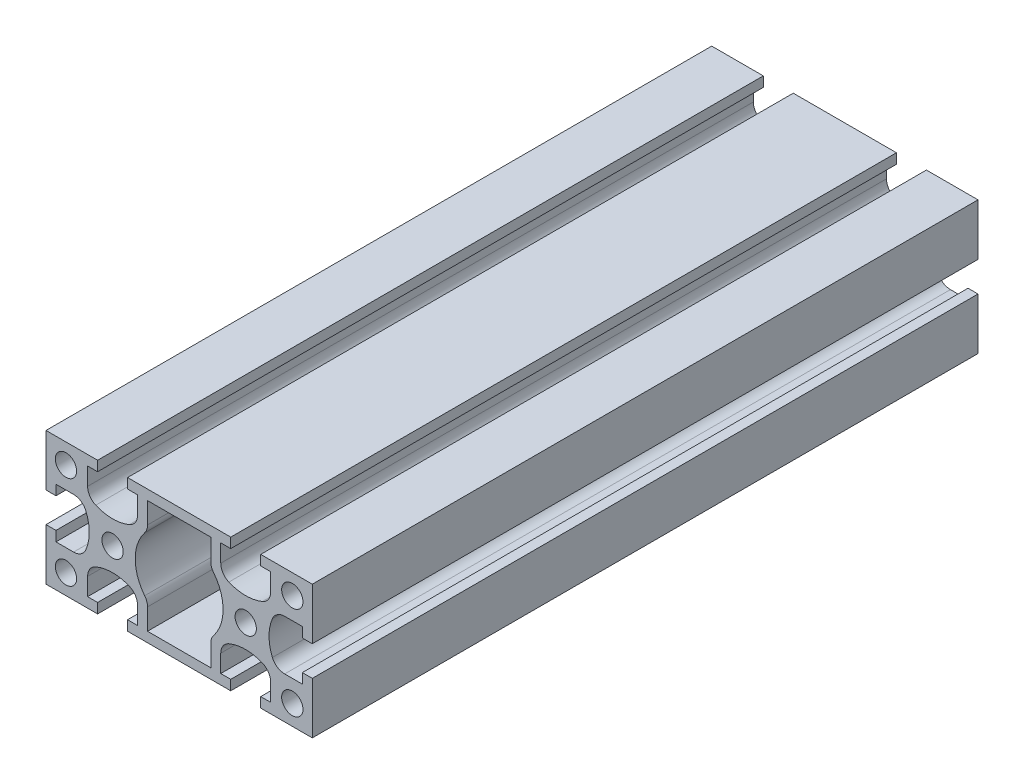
SolidWorks part; units mm, degrees
ref_plane "前基準面" through (0, 0, 0) normal (0, 0, 1) x (1, 0, 0)
ref_plane "上基準面" through (0, 0, 0) normal (0, 1, 0) x (1, 0, 0)
ref_plane "右基準面" through (0, 0, 0) normal (1, 0, 0) x (0, 0, -1)
sketch "草圖1" plane through (0, 0, 0) normal (0, 0, 1) x (1, 0, 0)
  line L0 (0, 11.9057) -> (0, -11.9057) construction
  line L1 (0, 0) -> (20, 0) construction
  line L2 (6.25, 8.5) -> (6.25, 4.6908)
  line L3 (7.75, 10) -> (7.75, 8.5)
  line L4 (12.25, 10) -> (12.25, 8.5)
  line L5 (18.5, 10) -> (18.5, 2.25) construction
  line L6 (-4.75, 8.5) -> (4.75, 8.5)
  line L7 (13.75, 8.5) -> (13.75, 4.6908)
  line L8 (12.25, 8.5) -> (13.75, 8.5)
  line L9 (14.6908, 3.75) -> (18.5, 3.75)
  line L10 (7.75, 10) -> (-7.75, 10)
  line L11 (12.25, 10) -> (20, 10)
  line L12 (20, 10) -> (20, 2.25)
  line L13 (10, 10) -> (10, 0.8816) construction
  line L14 (18.5, 3.75) -> (18.5, 2.25)
  line L15 (10, 10) -> (20, 10) construction
  line L16 (10, 8.5) -> (20, 8.5) construction
  line L17 (6.25, 10) -> (6.25, 0.8816) construction
  line L18 (12.25, 10) -> (12.25, 0.8816) construction
  line L19 (18.5, 2.25) -> (20, 2.25)
  line L20 (4.75, 8.5) -> (4.75, 4.5823)
  line L21 (18.5, -2.25) -> (20, -2.25)
  line L22 (7.75, 10) -> (7.75, 0.8816) construction
  line L23 (18.5, -3.75) -> (18.5, -2.25)
  line L24 (14.6908, -3.75) -> (18.5, -3.75)
  line L25 (13.75, 10) -> (13.75, 0.8816) construction
  line L26 (4.75, -8.5) -> (4.75, -4.5823)
  line L27 (-4.75, -8.5) -> (4.75, -8.5)
  line L28 (6.25, 8.5) -> (7.75, 8.5)
  line L29 (7.75, -10) -> (-7.75, -10)
  line L30 (-6.25, 8.5) -> (-7.75, 8.5)
  line L31 (7.75, -10) -> (7.75, -8.5)
  line L32 (6.25, -8.5) -> (7.75, -8.5)
  line L33 (6.25, -8.5) -> (6.25, -4.6908)
  line L34 (13.75, -8.5) -> (13.75, -4.6908)
  line L35 (12.25, -8.5) -> (13.75, -8.5)
  line L36 (12.25, -10) -> (12.25, -8.5)
  line L37 (12.25, -10) -> (20, -10)
  line L38 (20, -10) -> (20, -2.25)
  line L39 (-10, 10) -> (-10, 0.8816) construction
  line L40 (-6.25, -8.5) -> (-6.25, -4.6908)
  line L41 (-6.25, -8.5) -> (-7.75, -8.5)
  line L42 (-7.75, -10) -> (-7.75, -8.5)
  line L43 (-4.75, -8.5) -> (-4.75, -4.5823)
  line L44 (-7.75, 10) -> (-7.75, 8.5)
  line L45 (-4.75, 8.5) -> (-4.75, 4.5823)
  line L47 (-6.25, 8.5) -> (-6.25, 4.6908)
  line L48 (-20, -10) -> (-20, -2.25)
  line L49 (-12.25, -10) -> (-20, -10)
  line L50 (-12.25, -10) -> (-12.25, -8.5)
  line L51 (-12.25, -8.5) -> (-13.75, -8.5)
  line L52 (-13.75, -8.5) -> (-13.75, -4.6908)
  line L53 (-14.6908, -3.75) -> (-18.5, -3.75)
  line L54 (-18.5, -3.75) -> (-18.5, -2.25)
  line L55 (-18.5, -2.25) -> (-20, -2.25)
  line L56 (-18.5, 2.25) -> (-20, 2.25)
  line L57 (-18.5, 3.75) -> (-18.5, 2.25)
  line L58 (-20, 10) -> (-20, 2.25)
  line L59 (-12.25, 10) -> (-20, 10)
  line L60 (-14.6908, 3.75) -> (-18.5, 3.75)
  line L61 (-12.25, 8.5) -> (-13.75, 8.5)
  line L62 (-13.75, 8.5) -> (-13.75, 4.6908)
  line L63 (-12.25, 10) -> (-12.25, 8.5)
  arc A0 (6.25, 4.6908) -> (13.75, 4.6908) centre (10, 10) ccw
  arc A1 (14.6908, 3.75) -> (14.6908, -3.75) centre (20, 0) ccw
  circle A2 centre (17, 7) radius 1.6
  circle A3 centre (10, 0) radius 1.6
  arc A4 (4.75, -4.5823) -> (4.75, 4.5823) centre (0, 0) ccw
  arc A5 (6.25, -4.6908) -> (13.75, -4.6908) centre (10, -10) cw
  circle A6 centre (17, -7) radius 1.6
  arc A7 (-6.25, -4.6908) -> (-13.75, -4.6908) centre (-10, -10) ccw
  arc A8 (-4.75, -4.5823) -> (-4.75, 4.5823) centre (0, 0) cw
  circle A9 centre (-10, 0) radius 1.6
  arc A10 (-6.25, 4.6908) -> (-13.75, 4.6908) centre (-10, 10) cw
  circle A11 centre (-17, -7) radius 1.6
  circle A12 centre (-17, 7) radius 1.6
  arc A13 (-14.6908, 3.75) -> (-14.6908, -3.75) centre (-20, 0) cw
  point P23 (0, 8.5)
  point P70 (0, -10)
  point P73 (0, -8.5)
  point P75 (0, 10)
  dimension "D1" = 10
  dimension "D3" = 20
  dimension "D2" = 20
  dimension "D9" = 3.75
  dimension "D11" = 4.5
  dimension "D12" = 1.5
  dimension "D17" = 14
  dimension "D13" = 6.5
  dimension "D14" = 6.5
  dimension "D18" = 3.2
  dimension "D20" = 13.2
  dimension "D4" = 2.25
  dimension "D5" = 2.25
  dimension "D6" = 1.5
  dimension "D7" = 7.5
  dimension "D8" = 3.75
  dimension "D15" = 40
  dimension "D16" = 34
  dimension "D19" = 1.5
  dimension "D10" = 1.5
extrude "填料-伸長1" add sketch "草圖1" along normal mid plane 100
fillet "圓角1" radius 2 16 edges at (-4.75, -4.5823, 0) (-4.75, 4.5823, 0) (4.75, -4.5823, 0) (4.75, 4.5823, 0) (-6.25, -4.6908, 0) (-13.75, -4.6908, 0) (-14.6908, -3.75, 0) (-14.6908, 3.75, 0) (-13.75, 4.6908, 0) (-6.25, 4.6908, 0) (6.25, 4.6908, 0) (13.75, 4.6908, 0) (13.75, -4.6908, 0) (6.25, -4.6908, 0) (14.6908, 3.75, 0) (14.6908, -3.75, 0)
